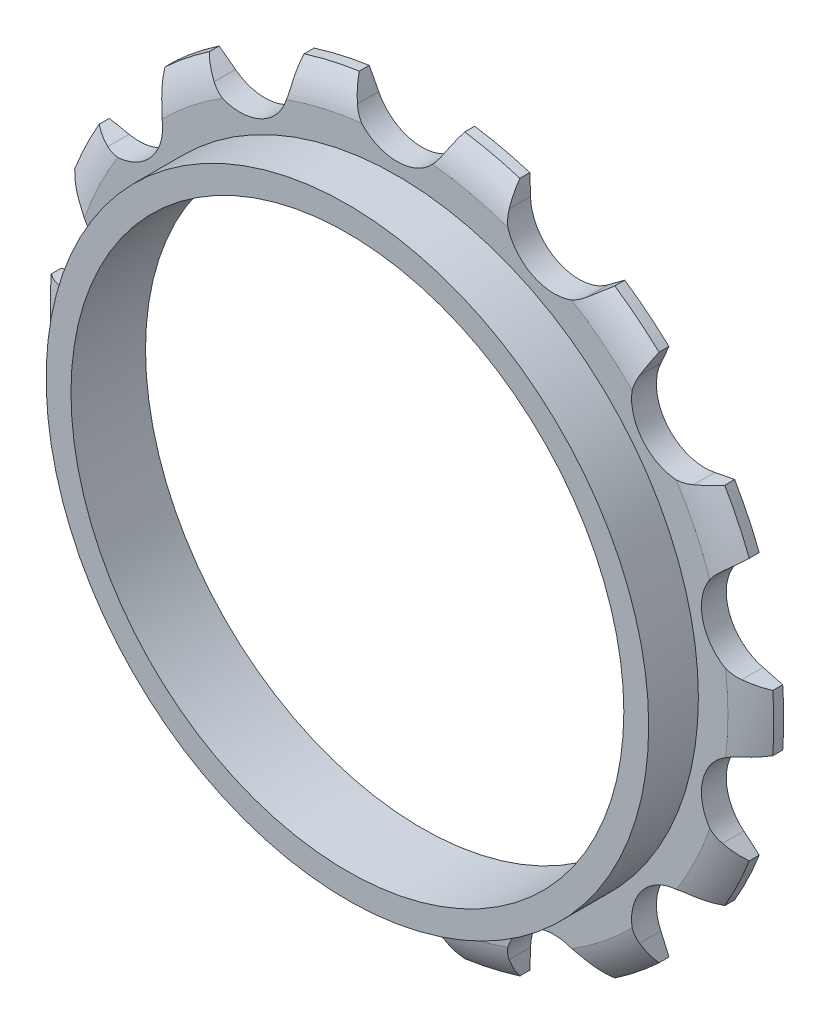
SolidWorks part; units mm, degrees
ref_plane "Front" through (0, 0, 0) normal (0, 0, 1) x (1, 0, 0)
ref_plane "Top" through (0, 0, 0) normal (0, 1, 0) x (1, 0, 0)
ref_plane "Right" through (0, 0, 0) normal (1, 0, 0) x (0, 0, -1)
sketch "Sketch1" plane through (0, 0, 0) normal (0, 0, 1) x (1, 0, 0)
  line L0 (0, 25.225) -> (0, 0) construction
  line L1 (0, 25.225) -> (0, 29.125) construction
  line L2 (0, 29.125) -> (0, 31.975) construction
  circle A0 centre (0, 0) radius 25.225 construction
  circle A3 centre (0, 0) radius 29.125 construction
  arc A4 (-5.7825, 31.4478) -> (-3.4818, 27.368) centre (-48.8344, 4.4817) cw
  arc A5 (5.7825, 31.4478) -> (3.4818, 27.368) centre (48.8344, 4.4817) ccw
  arc A6 (-3.4818, 27.368) -> (3.4818, 27.368) centre (0, 29.125) ccw
  arc A10 (5.7825, 31.4478) -> (-5.7825, 31.4478) centre (0, 0) ccw
  point P4 (6.3122, 28.4328)
  dimension "D1" = 2.85
  dimension "D2" = 3.9
  dimension "D3" = 50.8
  dimension "D5" = 11.5649
  dimension "D6" = 58.25
  dimension "D4" = 6.35
sketch "Sketch2" plane through (0, 0, 0) normal (1, 0, 0) x (0, 0, -1)
  line L0 (-1.2, 22.25) -> (0.8, 22.25)
  line L1 (0, 29.125) -> (0, -29.125) construction
  line L5 (-1.2, 22.25) -> (-1.2, 26.625)
  line L7 (0, 29.125) -> (0.8, 29.125)
  line L8 (0.8, 22.25) -> (0.8, 29.125)
  arc A0 (-1.2, 26.625) -> (0, 29.125) centre (4.1982, 25.5719) cw
  dimension "D4" = 2
  dimension "D7" = 5.5
  dimension "D1" = 22.25
  dimension "D5" = 2.5
  dimension "D6" = 0.8
ref_axis "Axis1" through (0, 0, -80.9) along (0, 0, 1)
revolve "Revolve1" add sketch "Sketch2" angle 360 about axis through (0, 0, -80.9) along (0, 0, 1)
extrude "Extrude1" cut sketch "Sketch1" against normal through all and the other way through all
pattern_circular "CirPattern1" count 14 over 360 about axis through (0, 0, 0) along (0, 0, 1) of "Extrude1"
sketch "Sketch4" plane through (0, 0, 1.2) normal (0, 0, 1) x (1, 0, 0)
  circle A0 centre (0, 0) radius 22.25 construction
  circle A1 centre (0, 0) radius 22.25
extrude "Extrude-Thin1" add sketch "Sketch4" along normal blind 4 thin
